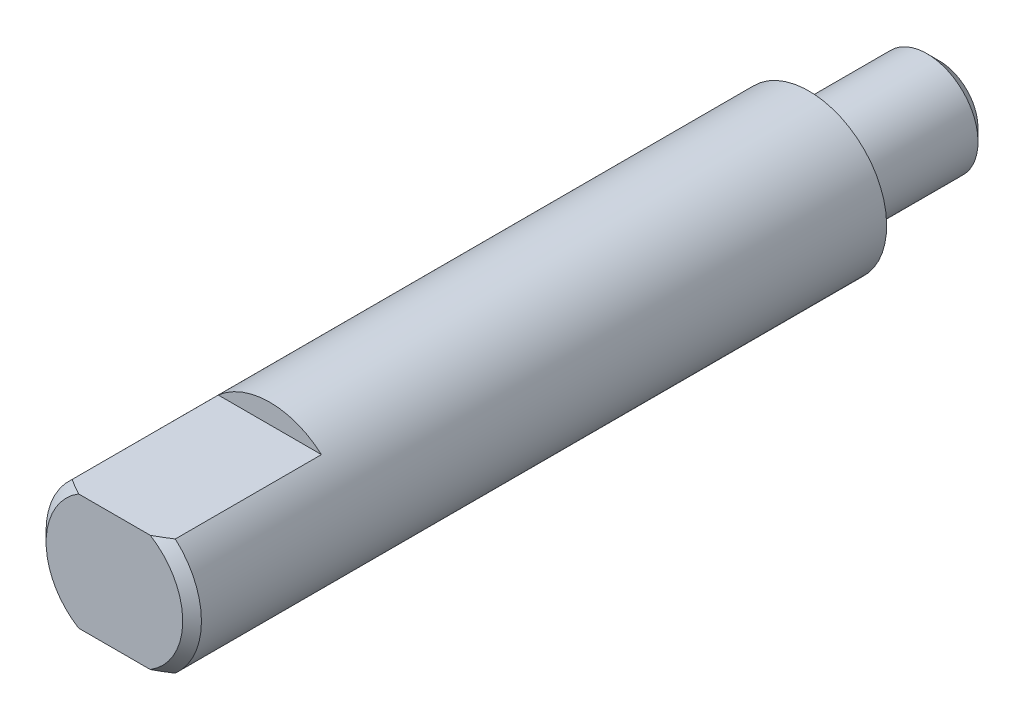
SolidWorks part; units mm, degrees
ref_plane "Front" through (0, 0, 0) normal (0, 0, 1) x (1, 0, 0)
ref_plane "Top" through (0, 0, 0) normal (0, 1, 0) x (1, 0, 0)
ref_plane "Right" through (0, 0, 0) normal (1, 0, 0) x (0, 0, -1)
sketch "Sketch1" plane through (0, 0, 0) normal (1, 0, 0) x (0, 0, -1)
  line L0 (29.6418, 1.57) -> (29.1318, 2.0828)
  line L1 (-4.064, 0) -> (29.6418, 0)
  line L2 (-4.064, 0) -> (-4.064, 2.79)
  line L3 (-3.684, 3.175) -> (24.3078, 3.175)
  line L4 (24.3078, 2.0828) -> (24.3078, 3.175)
  line L5 (153.7208, 0) -> (-49846.2792, 0) construction
  line L6 (-4.064, 2.79) -> (-3.684, 3.175)
  line L7 (24.3078, 2.0828) -> (29.1318, 2.0828)
  line L8 (29.6418, 0) -> (29.6418, 1.57)
  point P2 (0, 0)
  point P12 (-5.7756, 2.1565)
  dimension "D1" = 28.3718
  dimension "D2" = 3.175
  dimension "D3" = 4.1656
  dimension "D4" = 5.334
  dimension "D5" = 1.57
  dimension "D6" = 0.51
  dimension "D7" = 2.79
  dimension "D8" = 0.38
  dimension "D9" = 4.064
revolve "Revolve1" add sketch "Sketch1" angle 360 about L1
sketch "Sketch2" plane through (0, 0, 0) normal (1, 0, 0) x (0, 0, -1)
  line L0 (-4.064, 2.79) -> (-4.064, -2.79) construction
  line L1 (-4.064, 2.375) -> (2.286, 2.375)
  line L2 (-4.064, 2.375) -> (-4.064, 3.175)
  line L3 (-4.064, 3.175) -> (2.286, 3.175)
  line L4 (2.286, 2.375) -> (2.286, 3.175)
  line L5 (24.3078, 3.175) -> (-3.684, 3.175) construction
  line L6 (0, 0) -> (6.0811, 0) construction
  line L7 (2.286, -2.375) -> (2.286, -3.175)
  line L8 (-4.064, -3.175) -> (2.286, -3.175)
  line L9 (-4.064, -2.375) -> (-4.064, -3.175)
  line L10 (-4.064, -2.375) -> (2.286, -2.375)
  dimension "D1" = 0.8
  dimension "D2" = 6.35
extrude "Cut-Extrude1" cut sketch "Sketch2" against normal mid plane 10
